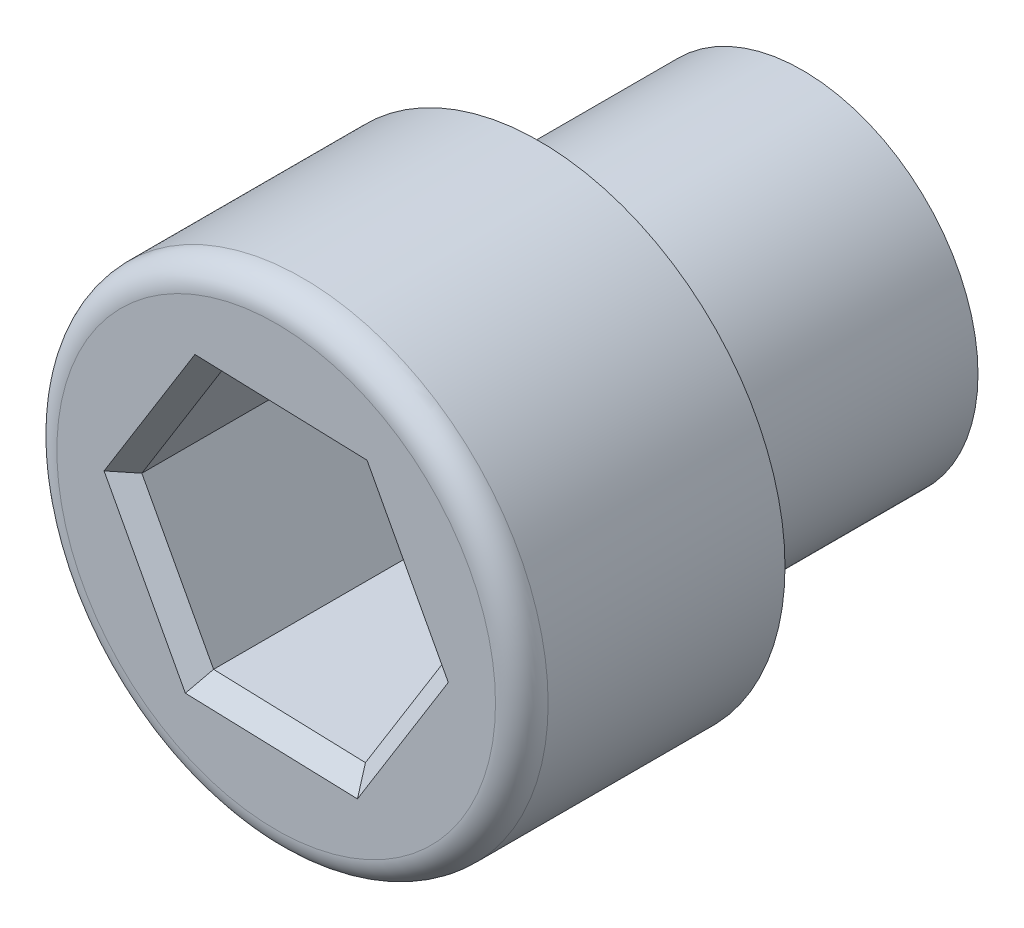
SolidWorks part; units mm, degrees
ref_plane "Płaszczyzna przednia" through (0, 0, 0) normal (0, 0, 1) x (1, 0, 0)
ref_plane "Płaszczyzna górna" through (0, 0, 0) normal (0, 1, 0) x (1, 0, 0)
ref_plane "Płaszczyzna prawa" through (0, 0, 0) normal (1, 0, 0) x (0, 0, -1)
sketch "Szkic1" plane through (0, 0, 0) normal (0, 0, 1) x (1, 0, 0)
  circle A0 centre (0, 0) radius 2
  dimension "D1" = 4
extrude "Dodanie-wyciągnięcie1" add sketch "Szkic1" along normal blind 3
sketch "Szkic2" plane through (0, 0, 3) normal (0, 0, 1) x (1, 0, 0)
  circle A0 centre (0, 0) radius 2.8
  dimension "D1" = 5.6
extrude "Dodanie-wyciągnięcie2" add sketch "Szkic2" along normal blind 3
fillet "Zaokrąglenie1" radius 0.3 1 edges at (2.8, 0, 6)
sketch "Szkic3" plane through (0, 0, 6) normal (0, 0, 1) x (1, 0, 0)
  line L1 (-0.8174, 1.527) -> (-1.7312, 0.0556)
  line L2 (-1.7312, 0.0556) -> (-0.9137, -1.4714)
  line L3 (-0.9137, -1.4714) -> (0.8174, -1.527)
  line L4 (0.8174, -1.527) -> (1.7312, -0.0556)
  line L5 (1.7312, -0.0556) -> (0.9137, 1.4714)
  line L6 (0.9137, 1.4714) -> (-0.8174, 1.527)
  circle A0 centre (0, 0) radius 1.5 construction
  dimension "D1" = 3
extrude "Wytnij-wyciągnięcie1" cut sketch "Szkic3" against normal blind 3
chamfer "Sfazowanie1" distance 0.2 angle 45 6 edges at (-0.0481, -1.4992, 6) (-1.3224, -0.7079, 6) (-1.2743, 0.7913, 6) (0.0481, 1.4992, 6) (1.3224, 0.7079, 6) (1.2743, -0.7913, 6)
